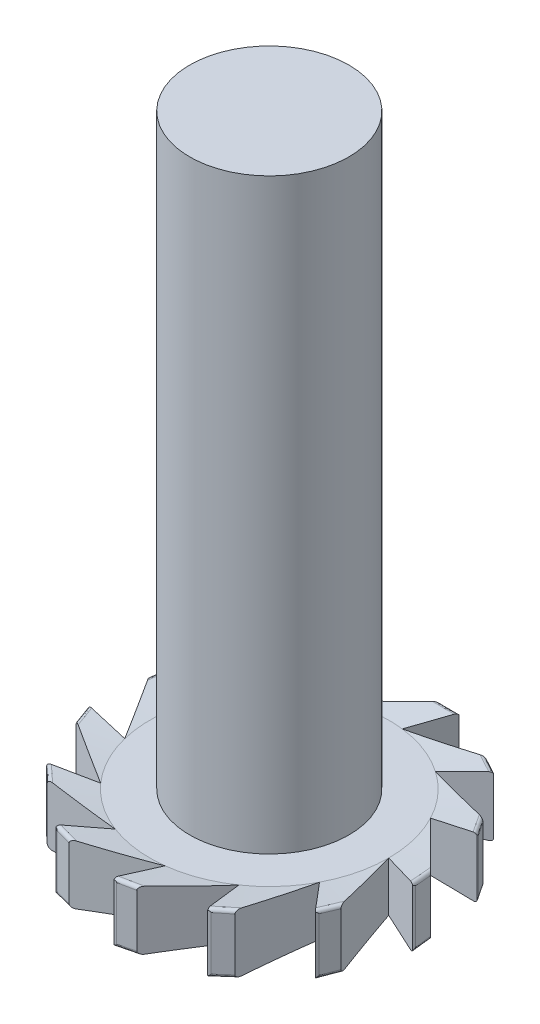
SolidWorks part; units mm, degrees
ref_plane "Front Plane" through (0, 0, 0) normal (0, 0, 1) x (1, 0, 0)
ref_plane "Top Plane" through (0, 0, 0) normal (0, 1, 0) x (1, 0, 0)
ref_plane "Right Plane" through (0, 0, 0) normal (1, 0, 0) x (0, 0, -1)
sketch "Sketch1" plane through (0, 0, 0) normal (0, 0, 1) x (1, 0, 0)
  line L0 (0, 0) -> (0, 50.8) construction
  line L1 (0, 0) -> (9.525, 0)
  line L2 (9.525, 0) -> (12.7, -0.4318)
  line L3 (12.7, -0.4318) -> (12.7, 4.3942)
  line L4 (12.7, 4.3942) -> (9.525, 3.9624)
  line L5 (9.525, 3.9624) -> (6.35, 3.9624)
  line L6 (6.35, 3.9624) -> (6.35, 50.8)
  line L7 (0, 50.8) -> (6.35, 50.8)
  line L8 (0, 0) -> (0, 50.8)
  dimension "D1" = 50.8
  dimension "D2" = 4.826
  dimension "D3" = 3.9624
  dimension "D4" = 3.175
  dimension "D5" = 0.4318
  dimension "D6" = 12.7
  dimension "D7" = 6.35
revolve "Revolve1" add sketch "Sketch1" angle 360 about L0
sketch "Sketch3" plane through (0, 50.8, 0) normal (0, 1, 0) x (1, 0, 0)
  line L0 (9.525, 0) -> (12.642, -1.2126)
  line L1 (9.525, 0) -> (11.3154, -5.7665)
  circle A0 centre (0, 0) radius 9.525 construction
  circle A1 centre (0, 0) radius 12.7 construction
extrude "Cut-Extrude2" cut sketch "Sketch3" against normal through all and the other way through all
pattern_circular "CirPattern1" count 13 over 360 about axis through (0, 4.3942, 0) along (0, -1, 0) of "Cut-Extrude2"
chamfer "Chamfer1" distance 1.778 angle 5 13 edges at (12.6991, 1.9812, -0.1525) (11.1736, 1.9812, -6.0366) (7.0884, 1.9812, -10.5378) (1.3793, 1.9812, -12.6249) (-9.6066, 1.9812, -8.3069) (-4.6458, 1.9812, -11.8198) (-12.3666, 1.9812, -2.891) (-12.2936, 1.9812, 3.1872) (-9.4042, 1.9812, 8.5352) (-4.3605, 1.9812, 11.9279) (1.6821, 1.9812, 12.5881) (7.3394, 1.9812, 10.3645) (11.3154, 1.9812, 5.7665)
fillet "Fillet1" radius 0.254 26 edges
